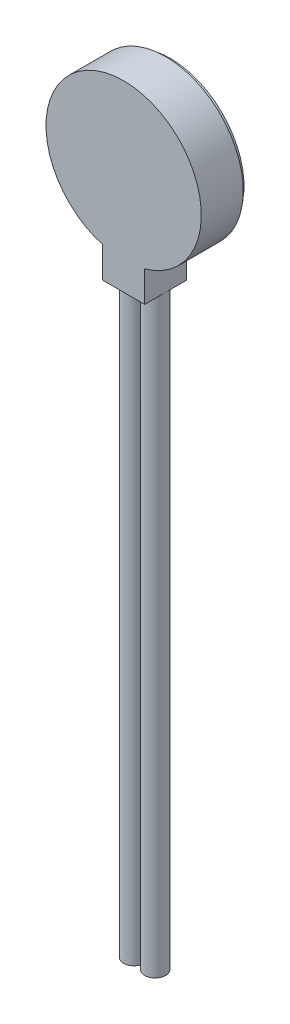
SolidWorks part; units mm, degrees
ref_plane "Front Plane" through (0, 0, 0) normal (0, 0, 1) x (1, 0, 0)
ref_plane "Top Plane" through (0, 0, 0) normal (0, 1, 0) x (1, 0, 0)
ref_plane "Right Plane" through (0, 0, 0) normal (1, 0, 0) x (0, 0, -1)
sketch "Sketch1" plane through (0, 0, 0) normal (0, 0, 1) x (1, 0, 0)
  circle A0 centre (0, 0) radius 5
  dimension "D1" = 10
extrude "Boss-Extrude1" add sketch "Sketch1" along normal blind 2.7
sketch "Sketch2" plane through (0, 0, 0) normal (0, 0, -1) x (-1, 0, 0)
  circle A0 centre (0, 0) radius 4.75
  dimension "D1" = 9.5
extrude "Boss-Extrude2" add sketch "Sketch2" along normal blind 0.3
sketch "Sketch3" plane through (0, 0, 0) normal (0, 1, 0) x (1, 0, 0)
  line L0 (-5, -2.7) -> (5, -2.7) construction
  line L1 (-1.35, 0) -> (1.35, 0)
  line L2 (-1.35, 0) -> (-1.35, -2.7)
  line L3 (-1.35, -2.7) -> (1.35, -2.7)
  line L4 (1.35, 0) -> (1.35, -2.7)
  point P6 (0, -2.7)
  dimension "D1" = 2.7
extrude "Boss-Extrude3" add sketch "Sketch3" against normal blind 6.8
sketch "Sketch4" plane through (0, -6.8, 0) normal (0, -1, 0) x (1, 0, 0)
  line L0 (-1.35, 0) -> (-1.35, 2.7) construction
  line L1 (-1.35, 0) -> (-1.35, 2.7) construction
  line L2 (1.35, 2.7) -> (1.35, 0) construction
  circle A0 centre (-0.6782, 1.35) radius 0.6718
  circle A1 centre (0.6782, 1.35) radius 0.6718
  point P4 (0.0063, 1.35)
  point P7 (-1.35, 1.35)
  point P14 (-0.0064, 1.35)
  dimension "D1" = 0.0127
extrude "Boss-Extrude4" add sketch "Sketch4" along normal blind 38.1
